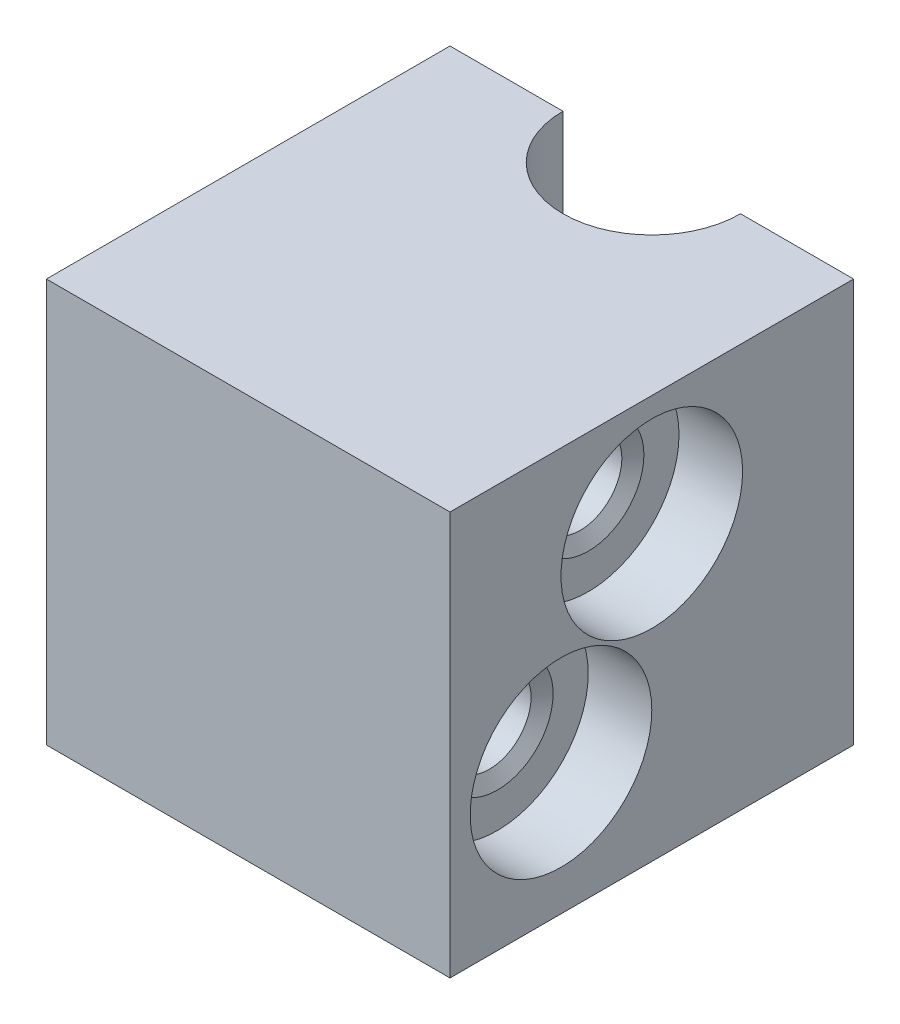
SolidWorks part; units mm, degrees
ref_plane "Front" through (0, 0, 0) normal (0, 0, 1) x (1, 0, 0)
ref_plane "Top" through (0, 0, 0) normal (0, 1, 0) x (1, 0, 0)
ref_plane "Right" through (0, 0, 0) normal (1, 0, 0) x (0, 0, -1)
sketch "Sketch1" plane through (0, 0, 0) normal (0, 0, 1) x (1, 0, 0)
  line L1 (0, 0) -> (50.8, 0)
  line L2 (0, 0) -> (0, 50.8)
  line L3 (0, 50.8) -> (50.8, 50.8)
  line L4 (50.8, 0) -> (50.8, 50.8)
  dimension "D1" = 50.8
  dimension "D2" = 50.8
extrude "Boss-Extrude1" add sketch "Sketch1" along normal blind 50.8
sketch "Sketch2" plane through (0, 50.8, 0) normal (0, 1, 0) x (1, 0, 0)
  line L0 (50.8, 0) -> (0, 0) construction
  line L1 (14.224, 0) -> (36.576, 0)
  arc A0 (14.224, 0) -> (36.576, 0) centre (25.4, 0) ccw
  dimension "D1" = 11.176
extrude "Cut-Extrude1" cut sketch "Sketch2" against normal up to next
hole_wizard "M12x1.5 Tapped Hole1" positions "Sketch4" profile "Sketch3" tap size "M12x1.5" standard "ANSI Metric"
sketch "Sketch4" plane through (50.8, 0, 0) normal (1, 0, 0) x (0, 0, -1)
  line L0 (0, 0) -> (0, 50.8) construction
  line L1 (-50.8, 50.8) -> (0, 50.8) construction
  point P0 (-36.83, 16.51)
  point P2 (-25.4, 36.83)
  dimension "D1" = 25.4
  dimension "D2" = 36.83
  dimension "D3" = 13.97
  dimension "D4" = 34.29
sketch "Sketch3" plane through (50.8, 16.51, 36.83) normal (0, 1, 0) x (0, 0, -1)
  line L0 (0, 0) -> (0, 50.8)
  line L1 (0, 50.8) -> (5.25, 50.8)
  line L2 (5.25, 50.8) -> (5.25, 0)
  line L5 (5.25, 0) -> (0, 0)
  line L11 (0, -6.35) -> (0, 107.95) construction
  dimension "Thru Tap Drill Dia." = 10.5
  dimension "Thru Tap Drill Depth" = 50.8
hole_wizard "M12x1.5 Tapped Hole2" positions "Sketch6" profile "Sketch5" tap size "M12x1.5" standard "ANSI Metric"
sketch "Sketch6" plane through (0, 0, 0) normal (-1, 0, 0) x (0, 0, 1)
  point P0 (36.83, 16.51)
  point P3 (25.4, 36.83)
sketch "Sketch5" [suppressed] plane through (0, 16.51, 36.83) normal (0, 1, 0) x (0, 0, 1)
  line L0 (0, 0) -> (0, 50.8)
  line L1 (0, 50.8) -> (5.25, 50.8)
  line L2 (5.25, 50.8) -> (5.25, 0)
  line L5 (5.25, 0) -> (0, 0)
  line L11 (0, -6.35) -> (0, 107.95) construction
  dimension "Thru Tap Drill Dia." = 10.5
  dimension "Thru Tap Drill Depth" = 50.8
sketch "Sketch7" plane through (0, 0, 0) normal (0, -1, 0) x (1, 0, 0)
  line L0 (0, 0) -> (50.8, 0) construction
  circle A0 centre (25.4, 25.4) radius 2.54
  circle A1 centre (25.4, 36.83) radius 2.54
  dimension "D3" = 5.08
  dimension "D1" = 25.4
  dimension "D2" = 36.83
extrude "Cut-Extrude2" cut sketch "Sketch7" against normal blind 8.89
hole_wizard "#50 (0.07) Diameter Hole1" positions "Sketch9" profile "Sketch10" hole size "#50" standard "ANSI Inch"
sketch "Sketch9" plane through (0, 8.89, 0) normal (0, -1, 0) x (-1, 0, 0)
  point P0 (-25.4, -25.4)
  point P3 (-25.4, -36.83)
sketch "Sketch10" plane through (25.4, 8.89, 25.4) normal (1, 0, 0) x (0, 0, -1)
  line L0 (0, 0) -> (0, 22.69)
  line L1 (0, 22.69) -> (0.889, 22.69)
  line L2 (0.889, 22.69) -> (0.889, 0)
  line L5 (0.889, 0) -> (0, 0)
  line L11 (0, -6.35) -> (0, 107.95) construction
  dimension "Thru Hole Dia." = 1.778
  dimension "Thru Hole Depth" = 22.69
sketch "Sketch12" plane through (50.8, 0, 0) normal (1, 0, 0) x (0, 0, -1)
  circle A0 centre (-36.83, 16.51) radius 11.43
  circle A1 centre (-25.4, 36.83) radius 11.43
  dimension "D1" = 22.86
  dimension "D2" = 22.86
extrude "Cut-Extrude3" cut sketch "Sketch12" against normal blind 8.001
ref_plane "Plane1" through (25.4, 0, 0) normal (1, 0, 0) x (0, 0, -1)
mirror "Mirror1" about plane through (25.4, 0, 0) normal (1, 0, 0) of "Cut-Extrude3"
hole_wizard "1/4-20 Tapped Hole1" positions "Sketch14" profile "Sketch13" tap size "1/4-20" standard "ANSI Inch"
sketch "Sketch14" plane through (0, 0, 0) normal (0, 0, -1) x (-1, 0, 0)
  point P0 (-6.35, 9.4488)
  point P3 (-44.45, 9.4488)
  point P6 (-44.45, 41.1988)
  point P9 (-6.35, 41.1988)
sketch "Sketch13" plane through (6.35, 9.4488, 0) normal (1, 0, 0) x (0, 1, 0)
  line L0 (0, 0) -> (0, 12.7)
  line L1 (0, 12.7) -> (2.5527, 12.7)
  line L2 (2.5527, 12.7) -> (2.5527, 0)
  line L5 (2.5527, 0) -> (0, 0)
  line L10 (0, 12.7) -> (-2.5527, 12.7) construction
  line L11 (0, -6.35) -> (0, 107.95) construction
  dimension "Tap Drill Dia." = 5.1054
  dimension "Tap Drill Depth" = 12.7
  dimension "Drill Angle" = 180
chamfer "Chamfer3" distance 1.016 angle 60 4 edges at (8.001, 36.83, 30.65) (8.001, 16.51, 42.08) (42.799, 36.83, 20.15) (42.799, 16.51, 31.58)
